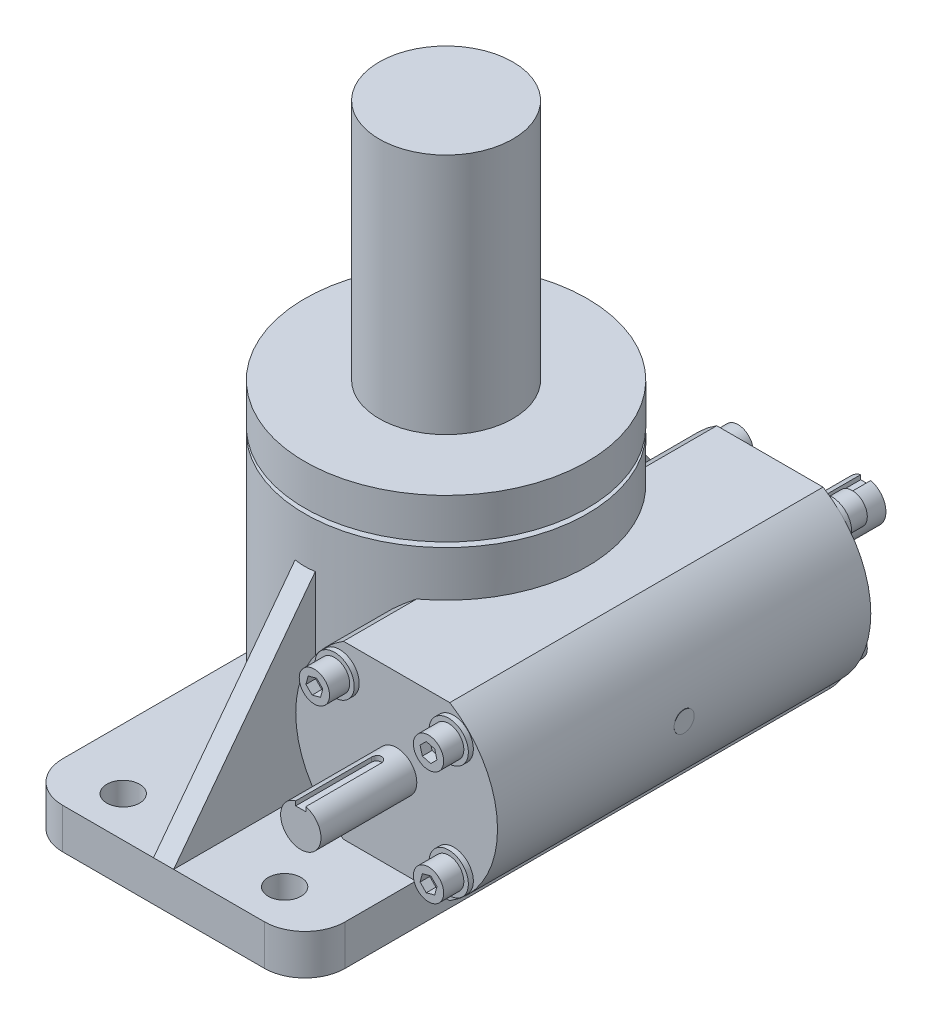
SolidWorks part; units mm, degrees
ref_plane "Front" through (0, 0, 0) normal (0, 0, 1) x (1, 0, 0)
ref_plane "Top" through (0, 0, 0) normal (0, 1, 0) x (1, 0, 0)
ref_plane "Right" through (0, 0, 0) normal (1, 0, 0) x (0, 0, -1)
ref_plane "Worm_Housing_1Limit" through (0, 0, -58.7375) normal (0, 0, 1) x (1, 0, 0)
ref_plane "Worm_Housing_2Limit" through (0, 0, 58.7375) normal (0, 0, 1) x (1, 0, 0)
sketch "Sketch1" plane through (0, 0, 0) normal (0, 0, 1) x (1, 0, 0)
  line L10 (0, 0) -> (-44.45, 0) construction
  line L11 (-44.45, 0) -> (-44.45, 85.7885) construction
  line L13 (-38.862, 85.7885) -> (-38.862, 87.3125) construction
  line L14 (-44.45, 85.7885) -> (-38.862, 85.7885) construction
  line L15 (-38.862, 87.3125) -> (-44.45, 87.3125) construction
  line L16 (-44.45, 87.3125) -> (-44.45, 100.0125) construction
  line L17 (-44.45, 100.0125) -> (0, 100.0125) construction
  line L18 (0, 0) -> (0, 100.0125) construction
  line L19 (0, 0) -> (0, 100.0125) construction
  line L20 (-21.0344, 176.2125) -> (-21.0344, 100.0125) construction
  line L22 (-21.0344, 176.2125) -> (0, 176.2125) construction
  line L26 (0, 0) -> (-44.45, 0)
  line L27 (-44.45, 0) -> (-44.45, 85.7885)
  line L28 (-38.862, 85.7885) -> (-38.862, 87.3125)
  line L29 (-44.45, 85.7885) -> (-38.862, 85.7885)
  line L30 (-38.862, 87.3125) -> (-44.45, 87.3125)
  line L31 (-44.45, 87.3125) -> (-44.45, 100.0125)
  line L32 (-44.45, 100.0125) -> (-21.0344, 100.0125)
  line L33 (-21.0344, 176.2125) -> (-21.0344, 100.0125)
  line L34 (-21.0344, 176.2125) -> (0, 176.2125)
  line L35 (0, 176.2125) -> (0, 0)
revolve "Base-Revolve" add sketch "Sketch1" angle 360 about L19
sketch "Sketch2" plane through (0, 0, 0) normal (0, 0, 1) x (1, 0, 0)
  line L0 (26.4546, 17.4625) -> (59.9054, 17.4625) construction
  line L3 (26.4546, 71.4375) -> (59.9054, 71.4375) construction
  line L4 (26.4546, 17.4625) -> (59.9054, 17.4625)
  line L5 (26.4546, 71.4375) -> (59.9054, 71.4375)
  arc A1 (59.9054, 17.4625) -> (59.9054, 71.4375) centre (43.18, 44.45) ccw construction
  arc A2 (26.4546, 71.4375) -> (26.4546, 17.4625) centre (43.18, 44.45) ccw construction
  arc A3 (59.9054, 17.4625) -> (59.9054, 71.4375) centre (43.18, 44.45) ccw
  arc A4 (26.4546, 71.4375) -> (26.4546, 17.4625) centre (43.18, 44.45) ccw
  point P7 (0, 0)
extrude "Boss-Extrude2" add sketch "Sketch2" along normal up to surface (58.7375 mm away) and the other way up to surface (58.7375 mm away)
ref_plane "Plane1" through (43.18, 0, 0) normal (-1, 0, 0) x (0, 0, 1)
sketch "Sketch3" plane through (43.18, 0, 0) normal (-1, 0, 0) x (0, 0, 1)
  line L0 (-105.8953, 44.45) -> (105.8953, 44.45) construction
  line L1 (-88.9, 38.1) -> (88.9, 38.1)
  line L2 (-88.9, 38.1) -> (-88.9, 44.45)
  line L3 (-88.9, 44.45) -> (88.9, 44.45)
  line L4 (88.9, 38.1) -> (88.9, 44.45)
revolve "Boss-Revolve1" add sketch "Sketch3" angle 360 about L0
sketch "Sketch5" plane through (0, 0, 0) normal (0, 1, 0) x (-1, 0, 0)
  line L4 (44.45, -88.9) -> (44.45, 88.9)
  line L5 (-44.45, -88.9) -> (44.45, -88.9)
  line L6 (-44.45, 88.9) -> (-44.45, -88.9)
  line L7 (44.45, 88.9) -> (-44.45, 88.9)
  line L8 (44.45, -88.9) -> (44.45, 88.9)
  line L9 (-44.45, -88.9) -> (44.45, -88.9)
  line L10 (-44.45, 88.9) -> (-44.45, -88.9)
  line L11 (44.45, 88.9) -> (-44.45, 88.9)
  circle A1 centre (25.4, -76.2) radius 5.1594 construction
  circle A3 centre (-25.4, -76.2) radius 5.1594 construction
  circle A4 centre (-25.4, 76.2) radius 5.1594 construction
  circle A5 centre (25.4, 76.2) radius 5.1594 construction
  circle A14 centre (25.4, -76.2) radius 5.1594
  circle A15 centre (-25.4, -76.2) radius 5.1594
  circle A16 centre (-25.4, 76.2) radius 5.1594
  circle A17 centre (25.4, 76.2) radius 5.1594
  dimension "D1" = 0
ref_plane "Plane2" through (0, 12.7, 0) normal (0, 1, 0) x (-1, 0, 0)
extrude "Boss-Extrude3" add sketch "Sketch5" along normal up to surface (12.7 mm away)
sketch "Sketch7" plane through (0, 0, 0) normal (0, 0, 1) x (1, 0, 0)
  line L0 (43.18, 44.45) -> (74.93, 44.45) construction
  line L1 (43.18, 44.45) -> (74.93, 44.45) construction
  line L2 (74.93, 41.275) -> (74.93, 44.45) construction
  line L3 (71.755, 44.45) -> (71.755, 41.275) construction
  line L4 (71.755, 41.275) -> (74.93, 41.275) construction
  line L5 (74.93, 44.45) -> (71.755, 44.45) construction
  line L6 (71.755, 44.45) -> (71.755, 41.275)
  line L7 (71.755, 41.275) -> (74.93, 41.275)
  line L8 (74.93, 41.275) -> (74.93, 44.45)
  line L9 (74.93, 44.45) -> (71.755, 44.45)
revolve "Boss-Revolve2" add sketch "Sketch7" angle 360 about L1
sketch "Sketch6" plane through (0, 0, 0) normal (0, 0, 1) x (1, 0, 0)
  line L2 (0, -41.275) -> (-12.7, -41.275) construction
  line L3 (0, 176.2125) -> (0, -41.275) construction
  line L4 (0, 173.6725) -> (0, -41.275)
  line L6 (-12.7, -41.275) -> (-12.7, 160.9725) construction
  line L8 (0, 0) -> (0, 100.0125) construction
  line L9 (0, 84.7725) -> (-18.4944, 84.7725) construction
  line L10 (-18.4944, 100.0125) -> (-18.4944, 84.7725) construction
  line L11 (-18.4944, 173.6725) -> (-18.4944, 100.0125) construction
  line L12 (-18.4944, 173.6725) -> (0, 173.6725) construction
  line L15 (0, -41.275) -> (-12.7, -41.275)
  line L16 (0, 0) -> (0, 100.0125) construction
  line L17 (-12.7, -41.275) -> (-12.7, 84.7725)
  line L18 (-12.7, 84.7725) -> (-18.4944, 84.7725)
  line L19 (-18.4944, 100.0125) -> (-18.4944, 84.7725)
  line L20 (-18.4944, 173.6725) -> (-18.4944, 100.0125)
  line L21 (-18.4944, 173.6725) -> (0, 173.6725)
revolve "Cut-Revolve1" cut sketch "Sketch6" angle 360 about L16
ref_plane "Plane3" through (0, 74.6125, 0) normal (0, 1, 0) x (-1, 0, 0)
sketch "Sketch4" plane through (0, 49.2125, 0) normal (0, 1, 0) x (-1, 0, 0)
  line L9 (-44.7675, -88.9) -> (-41.5925, -88.9)
  line L10 (-44.7675, -65.0875) -> (-44.7675, -88.9)
  line L11 (-41.5925, -88.9) -> (-41.5925, -65.0875)
  line L12 (-44.7675, -88.9) -> (-41.5925, -88.9)
  line L13 (-44.7675, -65.0875) -> (-44.7675, -88.9)
  line L14 (-41.5925, -88.9) -> (-41.5925, -65.0875)
  arc A3 (-41.5925, -65.0875) -> (-44.7675, -65.0875) centre (-43.18, -65.0875) ccw
  arc A4 (-41.5925, -65.0875) -> (-44.7675, -65.0875) centre (-43.18, -65.0875) ccw
  dimension "D2" = 0
extrude "Cut-Keyway1" cut sketch "Sketch4" against normal up to surface (25.4 mm away)
ref_plane "Plane4" through (0, 74.6125, 0) normal (0, 1, 0) x (-1, 0, 0)
sketch "Sketch9" plane through (0, 49.2125, 0) normal (0, 1, 0) x (-1, 0, 0)
  line L3 (-41.5925, 88.9) -> (-44.7675, 88.9)
  line L4 (-44.7675, 88.9) -> (-44.7675, 65.0875)
  line L5 (-41.5925, 65.0875) -> (-41.5925, 88.9)
  line L6 (-41.5925, 88.9) -> (-44.7675, 88.9)
  line L7 (-44.7675, 88.9) -> (-44.7675, 65.0875)
  line L8 (-41.5925, 65.0875) -> (-41.5925, 88.9)
  arc A1 (-44.7675, 65.0875) -> (-41.5925, 65.0875) centre (-43.18, 65.0875) ccw
  arc A2 (-44.7675, 65.0875) -> (-41.5925, 65.0875) centre (-43.18, 65.0875) ccw
  dimension "D1" = 0
extrude "Cut-Keyway2" cut sketch "Sketch9" along normal up to surface (25.4 mm away)
sketch "Sketch8" plane through (0, 0, 0) normal (1, 0, 0) x (0, 0, -1)
  line L0 (-88.9, 12.7) -> (-44.45, 71.4375)
  line L2 (-58.7375, 71.4375) -> (58.7375, 71.4375) construction
  line L3 (-44.45, 85.7885) -> (-44.45, 12.7) construction
rib "Rib1" sketch "Sketch8" sketch "Sketch8" thickness 6.35 extrusion direction parallel to sketch draft on no parameters "D1"=6.35
mirror "Mirror2" about plane through (0, 0, 0) normal (0, 0, 1) of "Rib1"
fillet "Fillet1" radius 12.7 4 edges at (44.45, 6.35, 88.9) (-44.45, 6.35, 88.9) (-44.45, 6.35, -88.9) (44.45, 6.35, -88.9)
sketch "Sketch11" plane through (22.2035, 31.4359, 58.7375) normal (0, 0, 1) x (1, 0, 0)
  line L0 (42.0071, 13.0141) -> (20.9765, 13.0141) construction
  line L1 (42.8437, -8.8531) -> (20.9765, 13.0141) construction
  line L3 (40.8812, -6.8907) -> (41.5929, -4.2347) construction
  line L4 (41.5929, -4.2347) -> (39.6486, -2.2904) construction
  line L5 (39.6486, -2.2904) -> (36.9927, -3.0021) construction
  line L6 (36.9927, -3.0021) -> (36.281, -5.658) construction
  line L7 (36.281, -5.658) -> (38.2253, -7.6023) construction
  line L8 (38.2253, -7.6023) -> (40.8812, -6.8907) construction
  circle A0 centre (20.9765, 13.0141) radius 25.4 construction
  circle A1 centre (38.937, -4.9464) radius 4.7625 construction
  circle A2 centre (38.937, -4.9464) radius 6.1849
  circle A3 centre (38.937, -4.9464) radius 2.3812 construction
  dimension "D1" = 50.8
  dimension "D3" = 9.525
  dimension "D4" = 12.3698
  dimension "D5" = 4.7625
  dimension "D2" = 45
extrude "Boss-Extrude1" add sketch "Sketch11" along normal blind 1.5748
sketch "Sketch31" plane through (22.2035, 31.4359, 60.3123) normal (0, 0, 1) x (1, 0, 0)
  circle A0 centre (38.937, -4.9464) radius 4.7625 construction
  circle A1 centre (38.937, -4.9464) radius 4.7625
extrude "Boss-Extrude21" add sketch "Sketch31" along normal blind 6.35
sketch "Sketch41" plane through (22.2035, 31.4359, 66.6623) normal (0, 0, 1) x (1, 0, 0)
  line L0 (36.9927, -3.0021) -> (36.281, -5.658) construction
  line L1 (36.281, -5.658) -> (38.2253, -7.6023) construction
  line L2 (38.2253, -7.6023) -> (40.8812, -6.8907) construction
  line L3 (40.8812, -6.8907) -> (41.5929, -4.2347) construction
  line L4 (41.5929, -4.2347) -> (39.6486, -2.2904) construction
  line L5 (39.6486, -2.2904) -> (36.9927, -3.0021) construction
  line L6 (36.9927, -3.0021) -> (36.281, -5.658)
  line L7 (36.281, -5.658) -> (38.2253, -7.6023)
  line L8 (38.2253, -7.6023) -> (40.8812, -6.8907)
  line L9 (40.8812, -6.8907) -> (41.5929, -4.2347)
  line L10 (41.5929, -4.2347) -> (39.6486, -2.2904)
  line L11 (39.6486, -2.2904) -> (36.9927, -3.0021)
extrude "Cut-Extrude1" cut sketch "Sketch41" against normal blind 3.048
pattern_circular "CirPattern1" count 4 over 360 about axis through (43.18, 44.45, 0) along (0, 0, 1) of "Boss-Extrude1", "Cut-Extrude1", "Boss-Extrude21"
other "4_Cap_Screws"
mirror "Mirror3" about plane through (0, 0, 0) normal (0, 0, 1) of "Boss-Extrude1", "Boss-Extrude21", "Cut-Extrude1", "CirPattern1"
